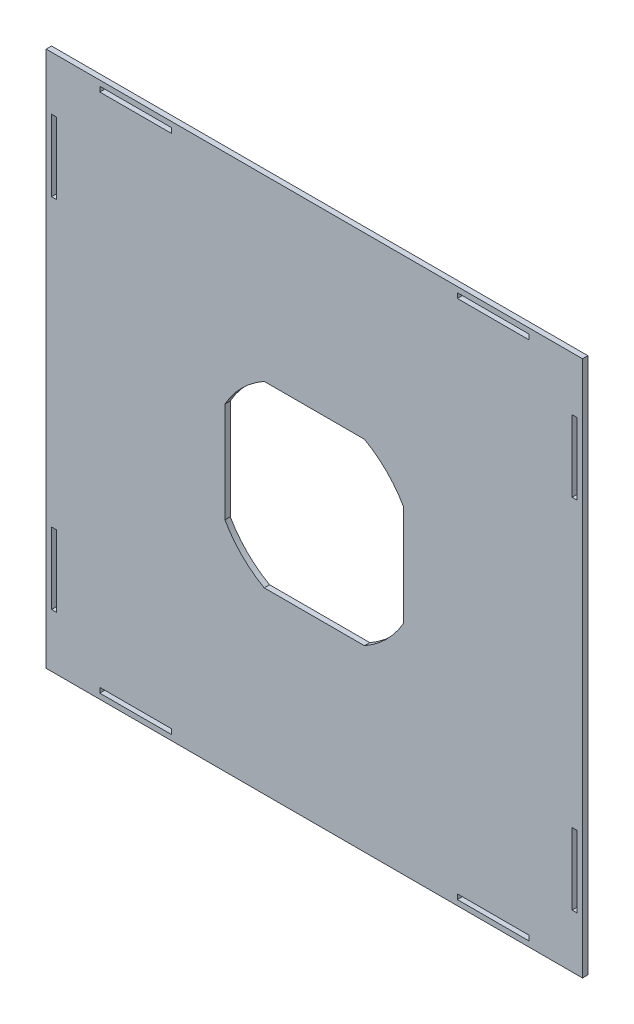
SolidWorks part; units mm, degrees
ref_plane "Alzado" through (0, 0, 0) normal (0, 0, 1) x (1, 0, 0)
ref_plane "Planta" through (0, 0, 0) normal (0, 1, 0) x (1, 0, 0)
ref_plane "Vista lateral" through (0, 0, 0) normal (1, 0, 0) x (0, 0, -1)
sketch "Croquis1" plane through (0, 0, 0) normal (0, 0, 1) x (1, 0, 0)
  line L0 (0, 0) -> (0, -150) construction
  line L5 (-150, -150) -> (150, -150)
  line L6 (-150, -150) -> (-150, 150)
  line L27 (-150, 150) -> (150, 150)
  line L28 (150, -150) -> (150, 150)
  line L29 (-150, -150) -> (150, 150) construction
  line L30 (-150, 150) -> (150, -150) construction
  line L31 (-120, -144.2) -> (-80, -144.2)
  line L32 (-120, -144.2) -> (-120, -147)
  line L33 (-120, -147) -> (-80, -147)
  line L34 (-80, -144.2) -> (-80, -147)
  line L39 (120, -147) -> (80, -147)
  line L40 (80, -144.2) -> (80, -147)
  line L41 (120, -144.2) -> (80, -144.2)
  line L42 (120, -144.2) -> (120, -147)
  line L43 (-144.2, 120) -> (-147, 120)
  line L44 (-144.2, 120) -> (-144.2, 80)
  line L45 (-144.2, 80) -> (-147, 80)
  line L46 (-147, 120) -> (-147, 80)
  line L47 (-147, -120) -> (-147, -80)
  line L48 (-144.2, -80) -> (-147, -80)
  line L49 (-144.2, -120) -> (-144.2, -80)
  line L50 (-144.2, -120) -> (-147, -120)
  line L51 (120, 144.2) -> (120, 147)
  line L52 (120, 144.2) -> (80, 144.2)
  line L53 (80, 144.2) -> (80, 147)
  line L54 (120, 147) -> (80, 147)
  line L55 (-120, 147) -> (-80, 147)
  line L56 (-80, 144.2) -> (-80, 147)
  line L57 (-120, 144.2) -> (-80, 144.2)
  line L58 (-120, 144.2) -> (-120, 147)
  line L59 (144.2, -120) -> (147, -120)
  line L60 (144.2, -120) -> (144.2, -80)
  line L61 (144.2, -80) -> (147, -80)
  line L62 (147, -120) -> (147, -80)
  line L63 (147, 120) -> (147, 80)
  line L64 (144.2, 80) -> (147, 80)
  line L65 (144.2, 120) -> (144.2, 80)
  line L66 (144.2, 120) -> (147, 120)
  point P0 (0, 0)
  point P43 (0, 0)
  dimension "D1" = 300
  dimension "D2" = 300
  dimension "D3" = 40
  dimension "D4" = 2.8
  dimension "D5" = 3
  dimension "D6" = 30
  dimension "D7" = 4
extrude "Saliente-Extruir1" add sketch "Croquis1" along normal blind 3
sketch "Croquis2" plane through (0, 0, 3) normal (0, 0, 1) x (1, 0, 0)
  line L1 (-28.0435, -50) -> (28.0435, -50)
  line L2 (-50, -28.0435) -> (-50, 28.0435)
  line L3 (-28.0435, 50) -> (28.0435, 50)
  line L4 (50, -28.0435) -> (50, 28.0435)
  line L5 (-50, -50) -> (50, 50) construction
  line L6 (-50, 50) -> (50, -50) construction
  arc A0 (28.0435, 50) -> (50, 28.0435) centre (0, 0) cw
  arc A1 (50, -28.0435) -> (28.0435, -50) centre (0, 0) cw
  arc A2 (-28.0435, -50) -> (-50, -28.0435) centre (0, 0) cw
  arc A3 (-50, 28.0435) -> (-28.0435, 50) centre (0, 0) cw
  point P0 (0, 0)
  point P18 (0, 0)
  dimension "D3" = 4
extrude "Cortar-Extruir1" cut sketch "Croquis2" against normal blind 10
